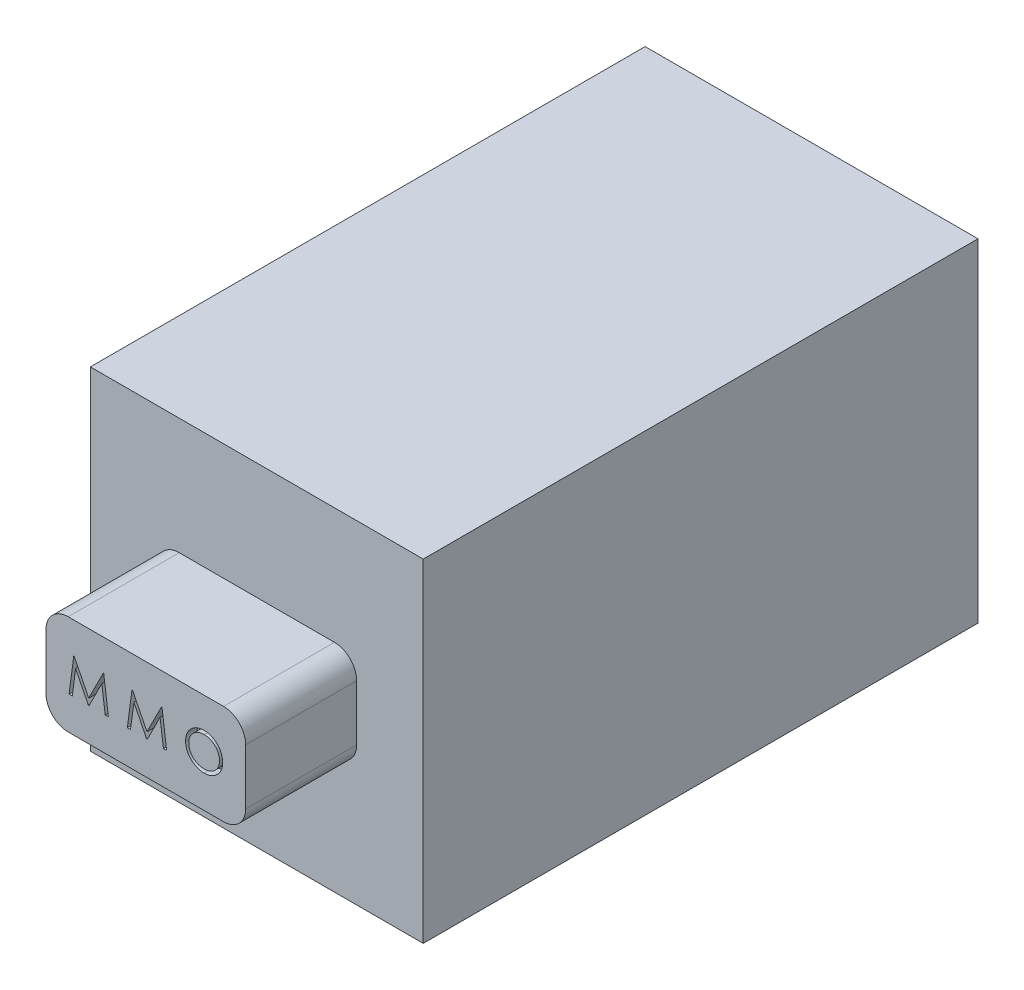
SolidWorks part; units mm, degrees
ref_plane "Plan de face" through (0, 0, 0) normal (0, 0, 1) x (1, 0, 0)
ref_plane "Plan de dessus" through (0, 0, 0) normal (0, 1, 0) x (1, 0, 0)
ref_plane "Plan de droite" through (0, 0, 0) normal (1, 0, 0) x (0, 0, -1)
sketch "Esquisse1" plane through (0, 0, 0) normal (0, 0, 1) x (1, 0, 0)
  line L1 (-7.5, -7.5) -> (7.5, -7.5)
  line L2 (-7.5, -7.5) -> (-7.5, 7.5)
  line L3 (-7.5, 7.5) -> (7.5, 7.5)
  line L4 (7.5, -7.5) -> (7.5, 7.5)
  line L5 (-7.5, -7.5) -> (7.5, 7.5) construction
  line L6 (-7.5, 7.5) -> (7.5, -7.5) construction
  point P0 (0, 0)
  dimension "D1" = 15
  dimension "D2" = 15
extrude "Boss.-Extru.1" add sketch "Esquisse1" along normal blind 25
sketch "Esquisse2" plane through (0, 0, 25) normal (0, 0, 1) x (1, 0, 0)
  line L1 (-3.5, -2.25) -> (3.5, -2.25)
  line L2 (-4.5, -1.25) -> (-4.5, 1.25)
  line L3 (-3.5, 2.25) -> (3.5, 2.25)
  line L4 (4.5, -1.25) -> (4.5, 1.25)
  line L5 (-4.5, -2.25) -> (4.5, 2.25) construction
  line L6 (-4.5, 2.25) -> (4.5, -2.25) construction
  arc A0 (3.5, 2.25) -> (4.5, 1.25) centre (3.5, 1.25) cw
  arc A1 (4.5, -1.25) -> (3.5, -2.25) centre (3.5, -1.25) cw
  arc A2 (-4.5, -1.25) -> (-3.5, -2.25) centre (-3.5, -1.25) ccw
  arc A3 (-4.5, 1.25) -> (-3.5, 2.25) centre (-3.5, 1.25) cw
  point P0 (0, 0)
  dimension "D3" = 1
  dimension "D1" = 4.5
  dimension "D2" = 9
extrude "Boss.-Extru.2" add sketch "Esquisse2" along normal blind 5
sketch "Esquisse3" plane through (0, 0, 30) normal (0, 0, 1) x (1, 0, 0)
  line L0 (-4.5, -0.75) -> (4.5, -0.75) construction
  line L1 (-4.5, 1.25) -> (-4.5, -1.25) construction
  line L2 (4.5, -1.25) -> (4.5, 1.25) construction
  line L3 (-3.5, -2.25) -> (3.5, -2.25) construction
  text T0 "O M M" font "Century Gothic" height in points 6
  dimension "D1" = 1.5
extrude "Enlèv. mat.-Extru.1" cut sketch "Esquisse3" against normal blind 0.5
